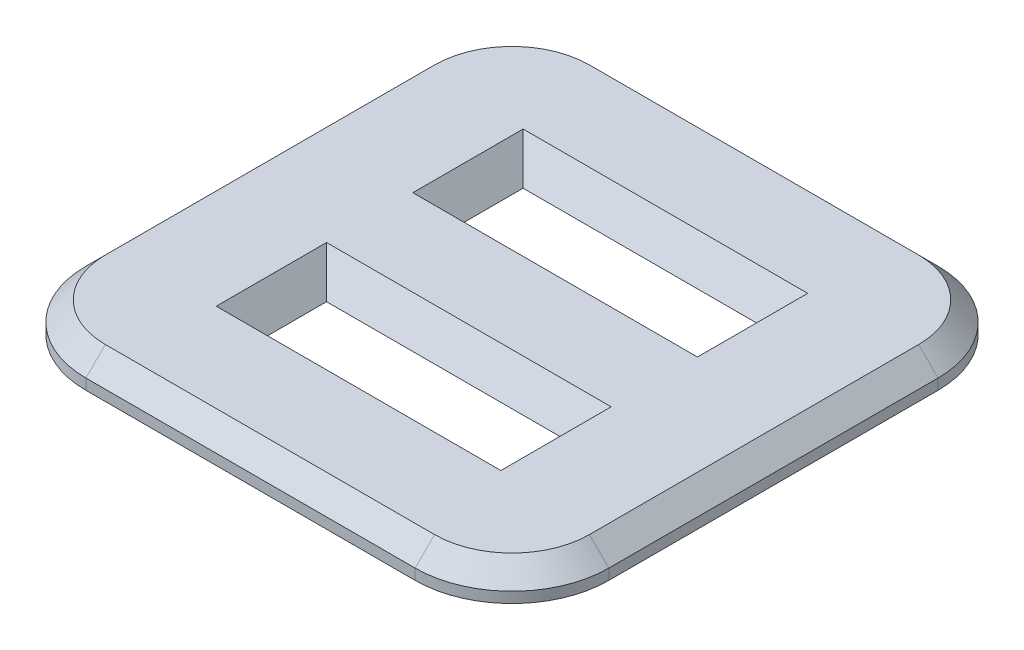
SolidWorks part; units mm, degrees
ref_plane "Front Plane" through (0, 0, 0) normal (0, 0, 1) x (1, 0, 0)
ref_plane "Top Plane" through (0, 0, 0) normal (0, 1, 0) x (1, 0, 0)
ref_plane "Right Plane" through (0, 0, 0) normal (1, 0, 0) x (0, 0, -1)
sketch "Sketch1" plane through (0, 0, 0) normal (0, 1, 0) x (1, 0, 0)
  line L1 (2.7, 2.7) -> (-2.7, 2.7)
  line L2 (2.7, 2.7) -> (2.7, -2.7)
  line L3 (2.7, -2.7) -> (-2.7, -2.7)
  line L4 (-2.7, 2.7) -> (-2.7, -2.7)
  line L5 (2.7, 2.7) -> (-2.7, -2.7) construction
  line L6 (2.7, -2.7) -> (-2.7, 2.7) construction
  point P0 (0, 0)
  dimension "D1" = 5.4
  dimension "D2" = 5.4
extrude "Boss-Extrude1" add sketch "Sketch1" along normal blind 0.31
fillet "Fillet1" radius 1 4 edges at (-2.7, 0.155, -2.7) (2.7, 0.155, -2.7) (2.7, 0.155, 2.7) (-2.7, 0.155, 2.7)
chamfer "Chamfer1" distance 0.2 angle 45 8 edges at (2.4071, 0.31, 2.4071) (0, 0.31, 2.7) (-2.4071, 0.31, 2.4071) (-2.7, 0.31, 0) (-2.4071, 0.31, -2.4071) (0, 0.31, -2.7) (2.4071, 0.31, -2.4071) (2.7, 0.31, 0)
sketch "Sketch2" plane through (0, 0.31, 0) normal (0, 1, 0) x (1, 0, 0)
  line L1 (1.25, 1.365) -> (-1.25, 1.365)
  line L2 (1.25, 1.365) -> (1.25, 0.665)
  line L3 (1.25, 0.665) -> (-1.25, 0.665)
  line L4 (-1.25, 1.365) -> (-1.25, 0.665)
  line L5 (1.25, 1.365) -> (-1.25, 0.665) construction
  line L6 (1.25, 0.665) -> (-1.25, 1.365) construction
  line L7 (-1.7, 2.7) -> (1.7, 2.7) construction
  line L8 (-2.5, 0) -> (2.5, 0) construction
  line L9 (-2.5, 1.7) -> (-2.5, -1.7) construction
  line L10 (2.5, -1.7) -> (2.5, 1.7) construction
  line L11 (1.25, -0.665) -> (-1.25, -0.665)
  line L12 (-1.25, -1.365) -> (-1.25, -0.665)
  line L13 (1.25, -1.365) -> (-1.25, -1.365)
  line L14 (1.25, -1.365) -> (1.25, -0.665)
  line L15 (2.7, 1.7) -> (2.7, -1.7) construction
  point P0 (0, 0)
  point P20 (0, 1.015)
  dimension "D1" = 2.5
  dimension "D2" = 0.7
  dimension "D3" = 1.335
  dimension "D4" = 2.7
extrude "Cut-Extrude1" cut sketch "Sketch2" against normal through all
chamfer "Chamfer2" distance 0.31 angle 35.3 8 edges at (1.25, 0.31, -1.015) (0, 0.31, -0.665) (-1.25, 0.31, -1.015) (0, 0.31, -1.365) (-1.25, 0.31, 1.015) (0, 0.31, 1.365) (1.25, 0.31, 1.015) (0, 0.31, 0.665)
